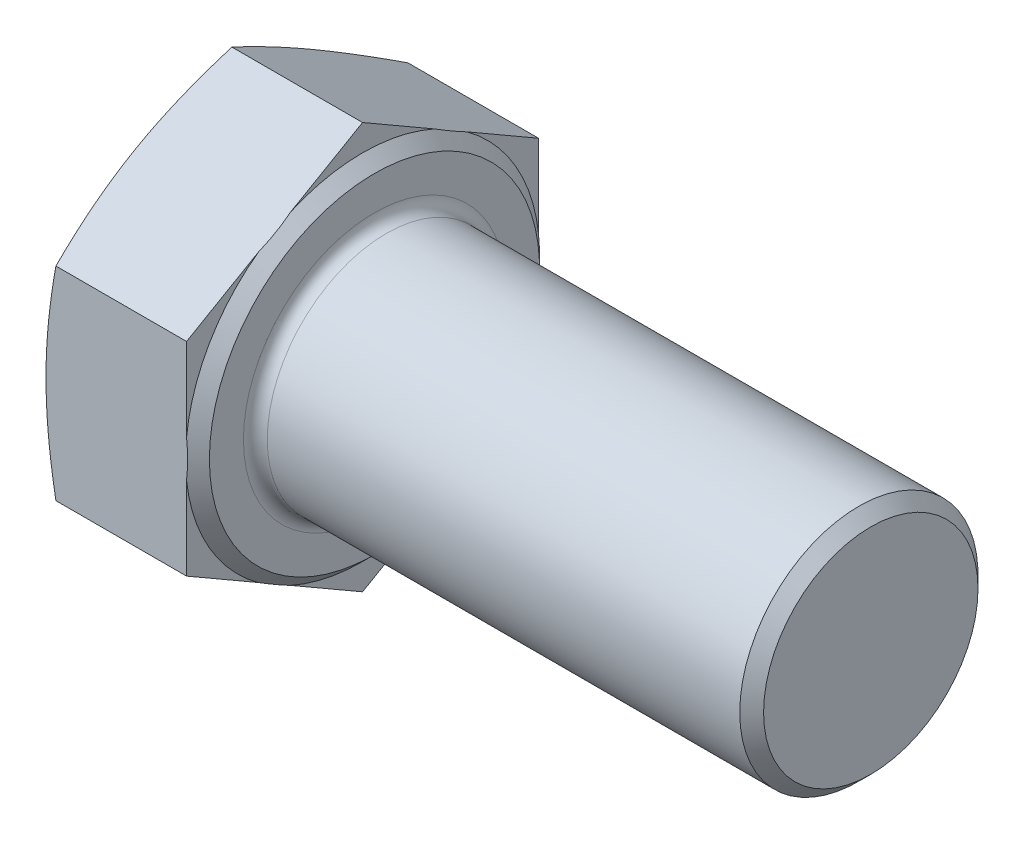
SolidWorks part; units mm, degrees
ref_plane "Front" through (0, 0, 0) normal (0, 0, 1) x (1, 0, 0)
ref_plane "Top" through (0, 0, 0) normal (0, 1, 0) x (1, 0, 0)
ref_plane "Right" through (0, 0, 0) normal (1, 0, 0) x (0, 0, -1)
sketch "Sketch2" plane through (0, 0, 0) normal (1, 0, 0) x (0, 0, -1)
  line L1 (8.865, -5.1182) -> (8.865, 5.1182)
  line L2 (8.865, 5.1182) -> (0, 10.2364)
  line L3 (0, 10.2364) -> (-8.865, 5.1182)
  line L4 (-8.865, 5.1182) -> (-8.865, -5.1182)
  line L5 (-8.865, -5.1182) -> (0, -10.2364)
  line L6 (0, -10.2364) -> (8.865, -5.1182)
  circle A0 centre (0, 0) radius 8.865 construction
  dimension "s" = 17.73
extrude "BaseHead" add sketch "Sketch2" along normal blind 7.68
sketch "Sketch3" plane through (0, 0, 0) normal (0, 0, 1) x (1, 0, 0)
  line L0 (7.68, 10.2364) -> (7.68, 8.315)
  line L2 (7.68, 8.315) -> (7.08, 8.915)
  line L3 (7.08, 8.915) -> (7.08, 10.2364)
  line L5 (7.08, 10.2364) -> (7.68, 10.2364)
  line L6 (-0.9571, 0) -> (7.6478, 0) construction
  line L7 (7.68, 10.2364) -> (0, 10.2364) construction
  dimension "D1" = 45
  dimension "c" = 0.6
  dimension "dw" = 16.63
revolve "BearingFace" cut sketch "Sketch3" angle 360 about L6
sketch "Sketch4" plane through (0, 0, 0) normal (0, 0, 1) x (1, 0, 0)
  line L0 (-0.4935, 0) -> (3.5626, 0) construction
  line L2 (0, 10.2364) -> (0.4992, 10.2364)
  line L4 (0.4992, 10.2364) -> (0, 8.865)
  line L6 (0, 8.865) -> (0, 10.2364)
  line L7 (7.08, 10.2364) -> (0, 10.2364) construction
  dimension "D1" = 20
  dimension "D2" = 17.73
revolve "HeadChamfer" cut sketch "Sketch4" angle 360 about L0
sketch "Sketch5" plane through (7.68, 0, 0) normal (1, 0, 0) x (0, 0, -1)
  circle A0 centre (0, 0) radius 6
  dimension "d" = 12
extrude "BaseBody" add sketch "Sketch5" along normal blind 25
chamfer "Chamfer1" distance 0.6 angle 45 1 edges at (32.68, 0, -6)
fillet "HeadFillet" radius 0.6 1 edges at (7.68, 0, -6)
equation "\"D2@Sketch4\" = \"s@Sketch2\""
equation "\"D1@Chamfer1\" = 0.05 * \"d@Sketch5\""
